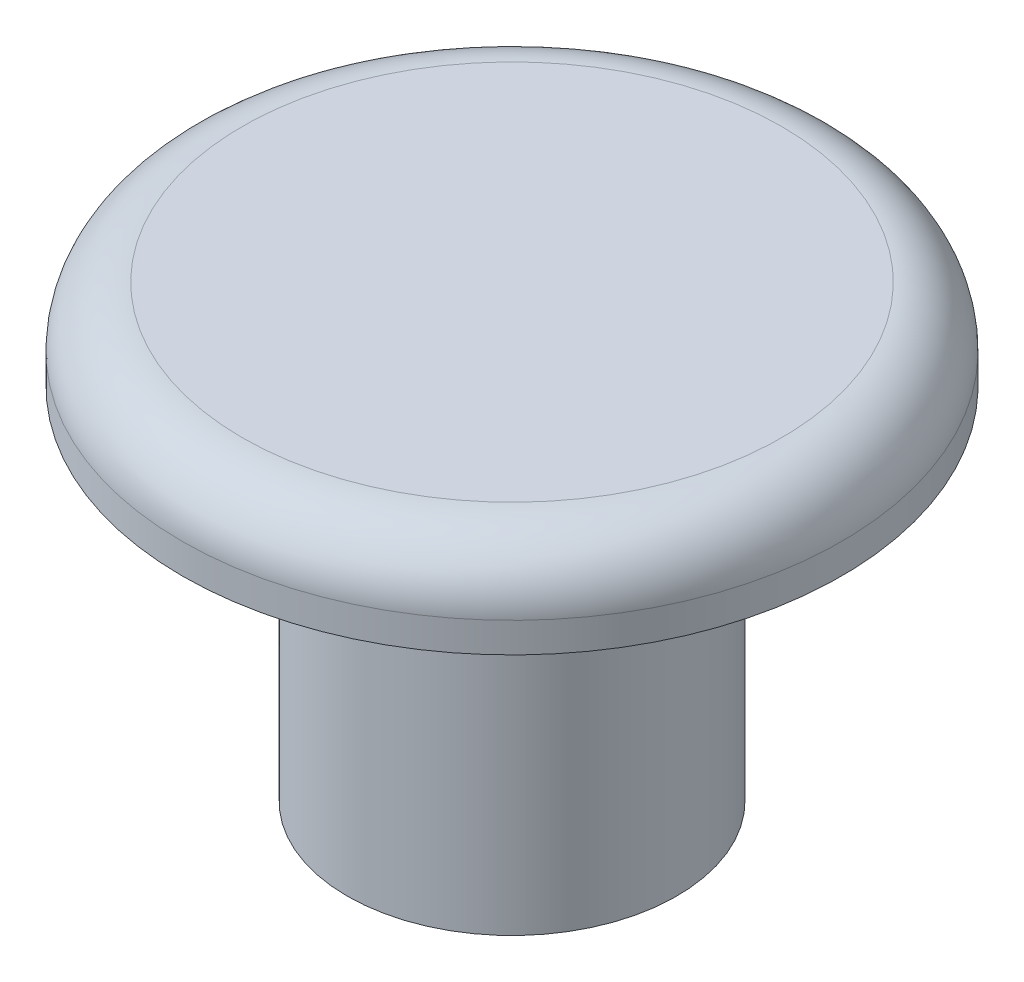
SolidWorks part; units mm, degrees
ref_plane "Front" through (0, 0, 0) normal (0, 0, 1) x (1, 0, 0)
ref_plane "Top" through (0, 0, 0) normal (0, 1, 0) x (1, 0, 0)
ref_plane "Right" through (0, 0, 0) normal (1, 0, 0) x (0, 0, -1)
sketch "Sketch2" plane through (0, 0, 0) normal (0, 0, 1) x (1, 0, 0)
  line L0 (0, 0) -> (0, -33.8497) construction
  line L1 (0, 0) -> (9, 0)
  line L2 (11, -2) -> (11, -3)
  line L3 (11, -3) -> (5.5, -3)
  line L4 (5.5, -3) -> (5.5, -15)
  line L5 (5.5, -15) -> (0, -15)
  line L6 (0, -15) -> (0, 0)
  arc A0 (9, 0) -> (11, -2) centre (9, -2) cw
  point P10 (11, 0)
  dimension "D5" = 2
  dimension "D1" = 11
  dimension "D2" = 22
  dimension "D3" = 12
  dimension "D4" = 3
revolve "Revolve1" add sketch "Sketch2" angle 360 about L0
